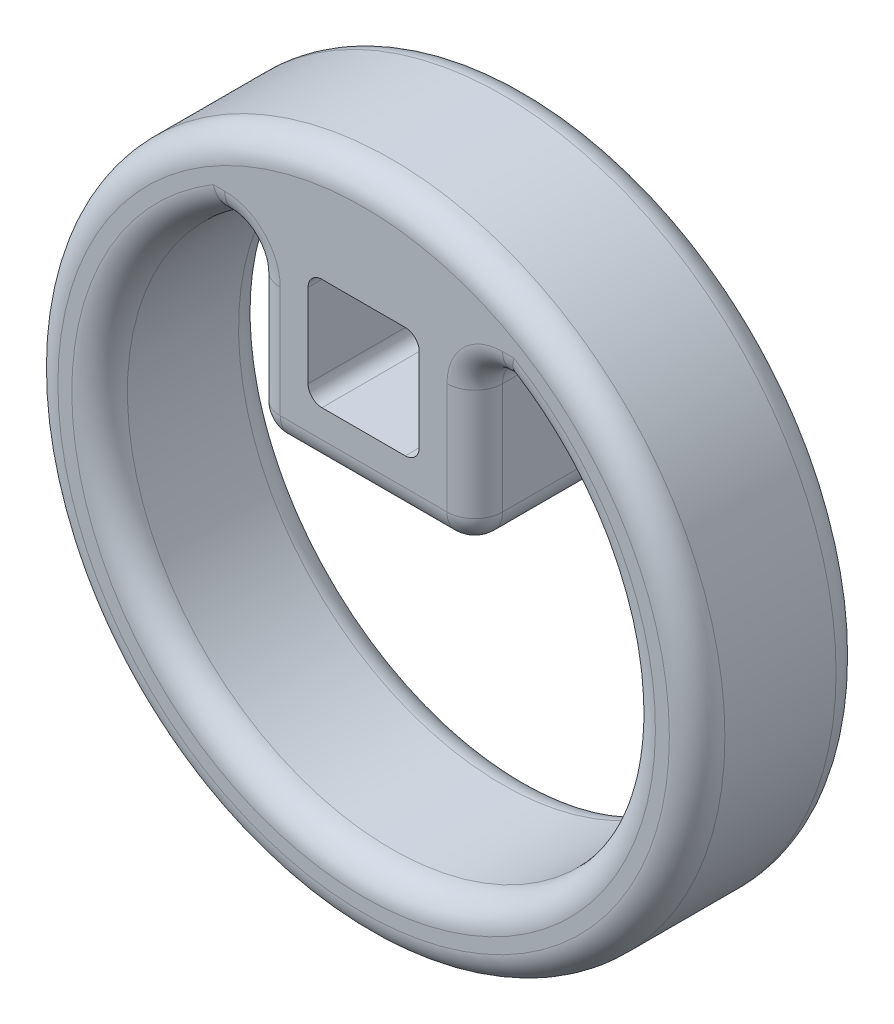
SolidWorks part; units mm, degrees
ref_plane "Front Plane" through (0, 0, 0) normal (0, 0, 1) x (1, 0, 0)
ref_plane "Top Plane" through (0, 0, 0) normal (0, 1, 0) x (1, 0, 0)
ref_plane "Right Plane" through (0, 0, 0) normal (1, 0, 0) x (0, 0, -1)
sketch "Sketch1" plane through (0, 0, 0) normal (0, 0, 1) x (1, 0, 0)
  line L0 (-3.6639, -0.7326) -> (4.3361, -0.7326) construction
  line L5 (-2.6639, 3.2674) -> (3.3361, 3.2674)
  line L6 (-3.6639, 2.2674) -> (-3.6639, -3.7326)
  line L7 (-2.6639, -4.7326) -> (3.3361, -4.7326)
  line L8 (4.3361, 2.2674) -> (4.3361, -3.7326)
  line L9 (0.3361, 3.2674) -> (0.3361, -4.7326) construction
  line L10 (-9.6639, 3.2674) -> (-9.9108, 3.2674)
  line L12 (-7.6639, 1.2674) -> (-7.6639, -6.7326)
  line L13 (-5.6639, -8.7326) -> (6.3361, -8.7326)
  line L14 (8.3361, 1.2674) -> (8.3361, -6.7326)
  line L15 (-3.371, 2.9745) -> (8.3361, -8.7326) construction
  line L16 (-7.6639, -8.7326) -> (4.0432, 2.9745) construction
  line L17 (10.3361, 3.2674) -> (10.5831, 3.2674)
  arc A0 (-3.6639, -3.7326) -> (-2.6639, -4.7326) centre (-2.6639, -3.7326) ccw
  arc A1 (3.3361, -4.7326) -> (4.3361, -3.7326) centre (3.3361, -3.7326) ccw
  arc A2 (3.3361, 3.2674) -> (4.3361, 2.2674) centre (3.3361, 2.2674) cw
  arc A3 (-2.6639, 3.2674) -> (-3.6639, 2.2674) centre (-2.6639, 2.2674) ccw
  circle A4 centre (0.3361, -12.7326) radius 24
  arc A5 (-9.9108, 3.2674) -> (10.5831, 3.2674) centre (0.3361, -12.7326) ccw
  arc A6 (6.3361, -8.7326) -> (8.3361, -6.7326) centre (6.3361, -6.7326) ccw
  arc A7 (-7.6639, -6.7326) -> (-5.6639, -8.7326) centre (-5.6639, -6.7326) ccw
  arc A8 (10.3361, 3.2674) -> (8.3361, 1.2674) centre (10.3361, 1.2674) ccw
  arc A9 (-9.6639, 3.2674) -> (-7.6639, 1.2674) centre (-9.6639, 1.2674) cw
  point P0 (0, 0)
  point P20 (0.3361, -0.7326)
  point P22 (0.3361, -0.7326)
  dimension "D1" = 1
  dimension "D4" = 48
  dimension "D6" = 5
  dimension "D7" = 2
  dimension "D2" = 8
  dimension "D3" = 8
  dimension "D5" = 12
  dimension "D8" = 4
  dimension "D9" = 4
  dimension "D10" = 4
extrude "Boss-Extrude1" add sketch "Sketch1" along normal blind 12
fillet "Fillet1" radius 2 4 edges at (0.3361, -31.7326, 0) (0.3361, -31.7326, 12) (24.3361, -12.7326, 12) (24.3361, -12.7326, 0)
fillet "Fillet2" radius 2 18 edges at (12.1369, 3.2674, 12) (8.9219, 2.6816, 12) (8.3361, -2.7326, 12) (7.7504, -8.1468, 12) (-11.4646, 3.2674, 12) (-8.2496, 2.6816, 12) (-7.6639, -2.7326, 12) (-7.0781, -8.1468, 12) (8.9219, 2.6816, 0) (-11.4646, 3.2674, 0) (-8.2496, 2.6816, 0) (-7.6639, -2.7326, 0) (-7.0781, -8.1468, 0) (0.3361, -8.7326, 12) (12.1369, 3.2674, 0) (7.7504, -8.1468, 0) (8.3361, -2.7326, 0) (0.3361, -8.7326, 0)
